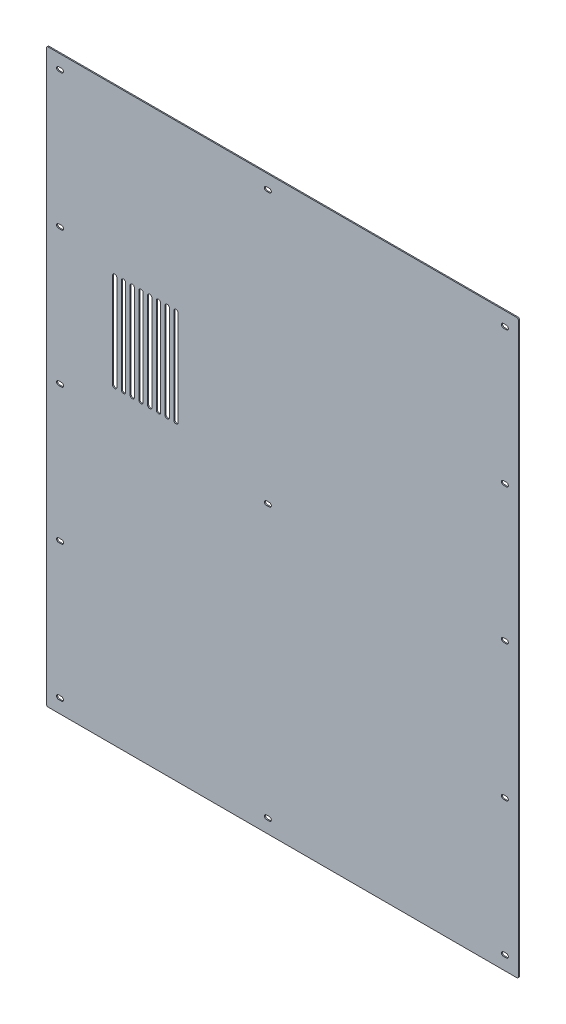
SolidWorks part; units mm, degrees
ref_plane "Ebene vorne" through (0, 0, 0) normal (0, 0, 1) x (1, 0, 0)
ref_plane "Ebene oben" through (0, 0, 0) normal (0, 1, 0) x (1, 0, 0)
ref_plane "Ebene rechts" through (0, 0, 0) normal (1, 0, 0) x (0, 0, -1)
sketch "Skizze1" plane through (0, 0, 0) normal (0, 0, 1) x (1, 0, 0)
  line L1 (-323.5, -392) -> (323.5, -392)
  line L2 (-323.5, -392) -> (-323.5, 392)
  line L3 (-323.5, 392) -> (323.5, 392)
  line L4 (323.5, -392) -> (323.5, 392)
  line L5 (-323.5, -392) -> (323.5, 392) construction
  line L6 (-323.5, 392) -> (323.5, -392) construction
  point P0 (0, 0)
  dimension "D1" = 647
  dimension "D2" = 784
base flange "Basis-Blech1" sketch "Skizze1" thickness 1.5 reverse thickness direction no parameters "D1"=8
hole_wizard "Durchgangsloch für M51" positions "Skizze7" profile "Skizze8" hole size "M5" standard "DIN"
sketch "Skizze7" plane through (0, 0, 0) normal (0, 0, 1) x (1, 0, 0)
  line L9 (-674.6731, 0) -> (0, 0) construction
  line L18 (0, 0) -> (0, 771.1759) construction
  line L20 (-305, -373) -> (-305, -186.5) construction
  line L21 (-305, -186.5) -> (-305, 0) construction
  line L22 (-305, 0) -> (-305, 186.5) construction
  line L23 (-305, 186.5) -> (-305, 373) construction
  line L26 (305, 373) -> (305, 186.5) construction
  line L27 (305, 186.5) -> (305, 0) construction
  line L28 (305, 0) -> (305, -186.5) construction
  line L29 (305, -186.5) -> (305, -373) construction
  line L33 (-323.5, 392) -> (-323.5, -392) construction
  line L34 (323.5, 392) -> (-323.5, 392) construction
  line L35 (323.5, -392) -> (323.5, 392) construction
  line L36 (0, 0) -> (0, -364.0549) construction
  line L37 (-20, 373) -> (-20, -373) construction
  point P108 (-305, -373)
  point P109 (-305, -186.5)
  point P111 (-305, 0)
  point P113 (-305, 186.5)
  point P115 (-305, 373)
  point P119 (305, 373)
  point P121 (305, 186.5)
  point P123 (305, 0)
  point P125 (305, -186.5)
  point P127 (305, -373)
  point P177 (-20, -373)
  point P178 (-20, 0)
  point P182 (-20, 373)
  dimension "D1" = 18.5
  dimension "D2" = 19
  dimension "D3" = 18.5
  dimension "D4" = 20
sketch "Skizze8" plane through (-20, 373, 0) normal (1, 0, 0) x (0, -1, 0)
  line L0 (0, 0) -> (0, 1.5)
  line L1 (0, 1.5) -> (2.75, 1.5)
  line L2 (2.75, 1.5) -> (2.75, 0)
  line L5 (2.75, 0) -> (0, 0)
  line L11 (0, -6.35) -> (0, 107.95) construction
  dimension "Bohrerdurchmesser" = 5.5
  dimension "Bohrungstiefe" = 1.5
break corner "Ecke brechen1" thickness 1.5 parameters "D1"=5, "D0"=5, "D7"=5
sketch "Skizze9" plane through (0, 0, 0) normal (0, 0, 1) x (1, 0, 0)
  line L0 (-307, 373) -> (-303, 373) construction
  line L1 (-307, 375.75) -> (-303, 375.75)
  line L2 (-307, 370.25) -> (-303, 370.25)
  line L3 (-307, 186.5) -> (-303, 186.5) construction
  line L4 (-307, 189.25) -> (-303, 189.25)
  line L5 (-307, 183.75) -> (-303, 183.75)
  line L6 (-307, 0) -> (-303, 0) construction
  line L7 (-307, 2.75) -> (-303, 2.75)
  line L8 (-307, -2.75) -> (-303, -2.75)
  line L9 (-307, -186.5) -> (-303, -186.5) construction
  line L10 (-307, -183.75) -> (-303, -183.75)
  line L11 (-307, -189.25) -> (-303, -189.25)
  line L12 (-307, -373) -> (-303, -373) construction
  line L13 (-307, -370.25) -> (-303, -370.25)
  line L14 (-307, -375.75) -> (-303, -375.75)
  line L15 (0, 0) -> (0, 493.5097) construction
  line L16 (307, 373) -> (303, 373) construction
  line L17 (307, 375.75) -> (303, 375.75)
  line L18 (307, 370.25) -> (303, 370.25)
  line L19 (307, 186.5) -> (303, 186.5) construction
  line L20 (307, 189.25) -> (303, 189.25)
  line L21 (307, 183.75) -> (303, 183.75)
  line L22 (307, 0) -> (303, 0) construction
  line L23 (307, 2.75) -> (303, 2.75)
  line L24 (307, -2.75) -> (303, -2.75)
  line L25 (307, -186.5) -> (303, -186.5) construction
  line L26 (307, -183.75) -> (303, -183.75)
  line L27 (307, -189.25) -> (303, -189.25)
  line L28 (307, -373) -> (303, -373) construction
  line L29 (307, -370.25) -> (303, -370.25)
  line L30 (307, -375.75) -> (303, -375.75)
  line L31 (-22, 373) -> (-18, 373) construction
  line L32 (-22, 375.75) -> (-18, 375.75)
  line L33 (-22, 370.25) -> (-18, 370.25)
  line L34 (-22, 0) -> (-18, 0) construction
  line L35 (-22, 2.75) -> (-18, 2.75)
  line L36 (-22, -2.75) -> (-18, -2.75)
  line L37 (-22, -373) -> (-18, -373) construction
  line L38 (-22, -370.25) -> (-18, -370.25)
  line L39 (-22, -375.75) -> (-18, -375.75)
  arc A0 (-307, 375.75) -> (-307, 370.25) centre (-307, 373) ccw
  arc A1 (-303, 370.25) -> (-303, 375.75) centre (-303, 373) ccw
  arc A2 (-307, 189.25) -> (-307, 183.75) centre (-307, 186.5) ccw
  arc A3 (-303, 183.75) -> (-303, 189.25) centre (-303, 186.5) ccw
  arc A4 (-307, 2.75) -> (-307, -2.75) centre (-307, 0) ccw
  arc A5 (-303, -2.75) -> (-303, 2.75) centre (-303, 0) ccw
  arc A6 (-307, -183.75) -> (-307, -189.25) centre (-307, -186.5) ccw
  arc A7 (-303, -189.25) -> (-303, -183.75) centre (-303, -186.5) ccw
  arc A8 (-307, -370.25) -> (-307, -375.75) centre (-307, -373) ccw
  arc A9 (-303, -375.75) -> (-303, -370.25) centre (-303, -373) ccw
  circle A10 centre (-305, -373) radius 2.75 construction
  arc A11 (307, 375.75) -> (307, 370.25) centre (307, 373) cw
  arc A12 (303, 370.25) -> (303, 375.75) centre (303, 373) cw
  arc A13 (307, 189.25) -> (307, 183.75) centre (307, 186.5) cw
  arc A14 (303, 183.75) -> (303, 189.25) centre (303, 186.5) cw
  arc A15 (307, 2.75) -> (307, -2.75) centre (307, 0) cw
  arc A16 (303, -2.75) -> (303, 2.75) centre (303, 0) cw
  arc A17 (307, -183.75) -> (307, -189.25) centre (307, -186.5) cw
  arc A18 (303, -189.25) -> (303, -183.75) centre (303, -186.5) cw
  arc A19 (307, -370.25) -> (307, -375.75) centre (307, -373) cw
  arc A20 (303, -375.75) -> (303, -370.25) centre (303, -373) cw
  arc A21 (-22, 375.75) -> (-22, 370.25) centre (-22, 373) ccw
  arc A22 (-18, 370.25) -> (-18, 375.75) centre (-18, 373) ccw
  arc A23 (-22, 2.75) -> (-22, -2.75) centre (-22, 0) ccw
  arc A24 (-18, -2.75) -> (-18, 2.75) centre (-18, 0) ccw
  arc A26 (-22, -370.25) -> (-22, -375.75) centre (-22, -373) ccw
  arc A28 (-18, -375.75) -> (-18, -370.25) centre (-18, -373) ccw
  point P2 (-305, 373)
  point P9 (-305, 186.5)
  point P17 (-305, 0)
  point P26 (-305, -186.5)
  point P34 (-305, -373)
  point P47 (305, 373)
  point P54 (305, 186.5)
  point P61 (305, 0)
  point P68 (305, -186.5)
  point P75 (305, -373)
  point P82 (-20, 373)
  point P88 (-20, 0)
  point P95 (-20, -373)
  dimension "D1" = 4
extrude "Schnitt-Linear austragen2" cut sketch "Skizze9" against normal through all
sketch "Skizze14" plane through (0, 0, 0) normal (0, 0, 1) x (1, 0, 0)
  line L0 (-230, 35) -> (-230, 165) construction
  line L1 (-233, 35) -> (-233, 165)
  line L2 (-227, 35) -> (-227, 165)
  arc A0 (-233, 35) -> (-227, 35) centre (-230, 35) ccw
  arc A1 (-227, 165) -> (-233, 165) centre (-230, 165) ccw
  point P2 (-230, 100)
  dimension "D1" = 6
  dimension "D2" = 130
  dimension "D3" = 100
  dimension "D4" = 230
extrude "Schnitt-Linear austragen5" cut sketch "Skizze14" against normal through all
pattern_linear "Lineares Muster1" count 8 spacing 12 along (1, 0, 0) of "Schnitt-Linear austragen5"
sketch "Skizze15" plane through (0, 0, 0) normal (0, 0, 1) x (1, 0, 0)
  line L0 (-18, 375.75) -> (-22, 375.75) construction
  line L1 (-22, 370.25) -> (-18, 370.25) construction
  line L2 (-18, 375.75) -> (-22, 375.75)
  line L3 (-22, 370.25) -> (-18, 370.25)
  line L4 (-22, -2.75) -> (-18, -2.75) construction
  line L5 (-18, 2.75) -> (-22, 2.75) construction
  line L6 (-22, -2.75) -> (-18, -2.75)
  line L7 (-18, 2.75) -> (-22, 2.75)
  line L8 (-22, -375.75) -> (-18, -375.75) construction
  line L9 (-18, -370.25) -> (-22, -370.25) construction
  line L10 (-22, -375.75) -> (-18, -375.75)
  line L11 (-18, -370.25) -> (-22, -370.25)
  arc A0 (-22, 375.75) -> (-22, 370.25) centre (-22, 373) ccw construction
  arc A1 (-18, 370.25) -> (-18, 375.75) centre (-18, 373) ccw construction
  arc A2 (-22, 375.75) -> (-22, 370.25) centre (-22, 373) ccw
  arc A3 (-18, 370.25) -> (-18, 375.75) centre (-18, 373) ccw
  arc A4 (-18, -2.75) -> (-18, 2.75) centre (-18, 0) ccw construction
  arc A5 (-22, 2.75) -> (-22, -2.75) centre (-22, 0) ccw construction
  arc A6 (-18, -2.75) -> (-18, 2.75) centre (-18, 0) ccw
  arc A7 (-22, 2.75) -> (-22, -2.75) centre (-22, 0) ccw
  arc A8 (-18, -375.75) -> (-18, -370.25) centre (-18, -373) ccw construction
  arc A9 (-22, -370.25) -> (-22, -375.75) centre (-22, -373) ccw construction
  arc A10 (-18, -375.75) -> (-18, -370.25) centre (-18, -373) ccw
  arc A11 (-22, -370.25) -> (-22, -375.75) centre (-22, -373) ccw
extrude "Aufsatz-Linear austragen1" [suppressed] add sketch "Skizze15" against normal up to surface (1.5 mm away)
sketch "Biegung-Linien1" [suppressed] plane through (0, 0, 0) normal (0, 1, 0) x (1, 0, 0)
sketch "Rahmen1" [suppressed] plane through (0, 0, 0) normal (0, 1, 0) x (1, 0, 0)
sheet metal parameters "Blech7" thickness 1.5 parameters "D1"=8
flat pattern "Abwicklung7"
sketch "Biegung-Linien2" plane through (0, 0, 0) normal (0, 1, 0) x (1, 0, 0)
sketch3d "Rahmen2" [suppressed]
  line L0 (-322.5, 400, 0) -> (-322.5, -400, 0) construction
  line L1 (322.5, 400, 0) -> (322.5, -400, 0) construction
  line L2 (-322.5, 400, 0) -> (322.5, 400, 0) construction
  line L3 (-322.5, -400, 0) -> (322.5, -400, 0) construction
sheet metal parameters "Blech9" thickness 1.5 parameters "D1"=8
flat pattern "Abwicklung7"
sketch "Biegung-Linien2" plane through (0, 0, 0) normal (0, 1, 0) x (1, 0, 0)
sketch3d "Rahmen2" [suppressed]
  line L0 (322.4996, -400, 0) -> (322.5, 400, 0) construction
  line L1 (-322.5, -399.9996, 0) -> (-322.4996, 400.0004, 0) construction
  line L2 (322.4996, -400, 0) -> (-322.5, -399.9996, 0) construction
  line L3 (322.5, 400, 0) -> (-322.4996, 400.0004, 0) construction
sheet metal parameters "Blech10" thickness 1.5 parameters "D1"=8
flat pattern "Abwicklung7"
sketch "Biegung-Linien2" plane through (0, 0, 0) normal (0, 1, 0) x (1, 0, 0)
sketch3d "Rahmen2" [suppressed]
  line L0 (322.4996, -400, 0) -> (322.5, 400, 0) construction
  line L1 (-322.5, -399.9996, 0) -> (-322.4996, 400.0004, 0) construction
  line L2 (322.4996, -400, 0) -> (-322.5, -399.9996, 0) construction
  line L3 (322.5, 400, 0) -> (-322.4996, 400.0004, 0) construction
sheet metal parameters "Blech14" thickness 1.5 parameters "D1"=8
flat pattern "Abwicklung7"
sketch "Biegung-Linien2" plane through (0, 0, 0) normal (0, 1, 0) x (1, 0, 0)
sketch3d "Rahmen2" [suppressed]
  line L0 (322.4996, -400, 0) -> (322.5, 400, 0) construction
  line L1 (-322.5, -399.9996, 0) -> (-322.4996, 400.0004, 0) construction
  line L2 (322.4996, -400, 0) -> (-322.5, -399.9996, 0) construction
  line L3 (322.5, 400, 0) -> (-322.4996, 400.0004, 0) construction
sheet metal parameters "Blech15" thickness 1.5 parameters "D1"=8
flat pattern "Abwicklung7"
sketch "Biegung-Linien2" plane through (0, 0, 0) normal (0, 1, 0) x (1, 0, 0)
sketch3d "Rahmen2" [suppressed]
  line L0 (323.4996, -392, 0) -> (323.5, 392, 0) construction
  line L1 (-323.5, -391.9996, 0) -> (-323.4996, 392.0004, 0) construction
  line L2 (323.4996, -392, 0) -> (-323.5, -391.9996, 0) construction
  line L3 (323.5, 392, 0) -> (-323.4996, 392.0004, 0) construction
sheet metal parameters "Blech16" thickness 1.5 parameters "D1"=8
flat pattern "Abwicklung7"
sketch "Biegung-Linien2" plane through (0, 0, 0) normal (0, 1, 0) x (1, 0, 0)
sketch3d "Rahmen2" [suppressed]
  line L0 (323.4996, -392, 0) -> (323.5, 392, 0) construction
  line L1 (-323.5, -391.9996, 0) -> (-323.4996, 392.0004, 0) construction
  line L2 (323.4996, -392, 0) -> (-323.5, -391.9996, 0) construction
  line L3 (323.5, 392, 0) -> (-323.4996, 392.0004, 0) construction
